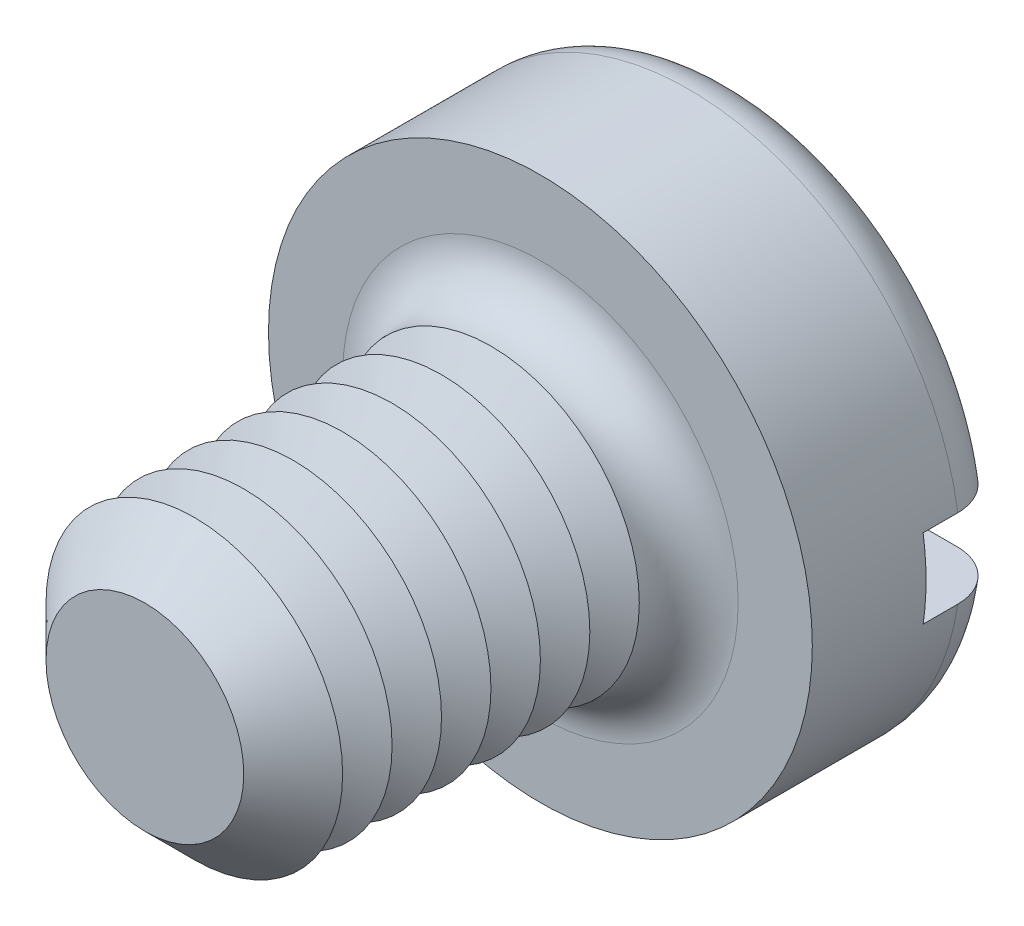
SolidWorks part; units mm, degrees
ref_plane "Front Plane" through (0, 0, 0) normal (0, 0, 1) x (1, 0, 0)
ref_plane "Top Plane" through (0, 0, 0) normal (0, 1, 0) x (1, 0, 0)
ref_plane "Right Plane" through (0, 0, 0) normal (1, 0, 0) x (0, 0, -1)
sketch "Sketch3" plane through (0, 0, 0) normal (0, 0, 1) x (1, 0, 0)
  circle A0 centre (0, 0) radius 2.75
  dimension "D1" = 5.5
extrude "Boss-Extrude2" add sketch "Sketch3" against normal blind 2
sketch "Sketch4" plane through (0, 0, 0) normal (0, 0, 1) x (1, 0, 0)
  circle A0 centre (0, 0) radius 1.5
  dimension "D1" = 3
extrude "Boss-Extrude3" add sketch "Sketch4" along normal blind 4
fillet "Fillet1" radius 0.5 2 edges at (2.75, 0, -2) (1.5, 0, 0)
chamfer "Chamfer1" distance 0.5 angle 45 1 edges at (1.5, 0, 4)
sketch "Sketch5" plane through (0, 0, 0) normal (1, 0, 0) x (0, 0, -1)
  line L0 (1.6944, 0) -> (-7.6738, 0) construction
sketch "Sketch6" plane through (0, 0, 0) normal (1, 0, 0) x (0, 0, -1)
  line L0 (-0.5, 1.5) -> (-0.75, 1.067)
  line L1 (-0.75, 1.067) -> (-1, 1.5)
  line L2 (-0.5, 1.5) -> (-3.5, 1.5) construction
  line L3 (-1, 1.5) -> (-0.5, 1.5)
  dimension "D1" = 0.5
revolve "Cut-Revolve1" cut sketch "Sketch6" angle 360 about L0
pattern_linear "LPattern1" count 6 spacing 0.5 along (0, 0, 1) of "Cut-Revolve1"
sketch "Sketch8" plane through (0, 0, -2) normal (0, 0, -1) x (-1, 0, 0)
  line L1 (2.75, -0.4) -> (-2.75, -0.4)
  line L2 (2.75, -0.4) -> (2.75, 0.4)
  line L3 (2.75, 0.4) -> (-2.75, 0.4)
  line L4 (-2.75, -0.4) -> (-2.75, 0.4)
  line L5 (2.75, -0.4) -> (-2.75, 0.4) construction
  line L6 (2.75, 0.4) -> (-2.75, -0.4) construction
  point P0 (0, 0)
  dimension "D1" = 5.5
  dimension "D2" = 0.8
extrude "Cut-Extrude1" cut sketch "Sketch8" against normal blind 0.85
